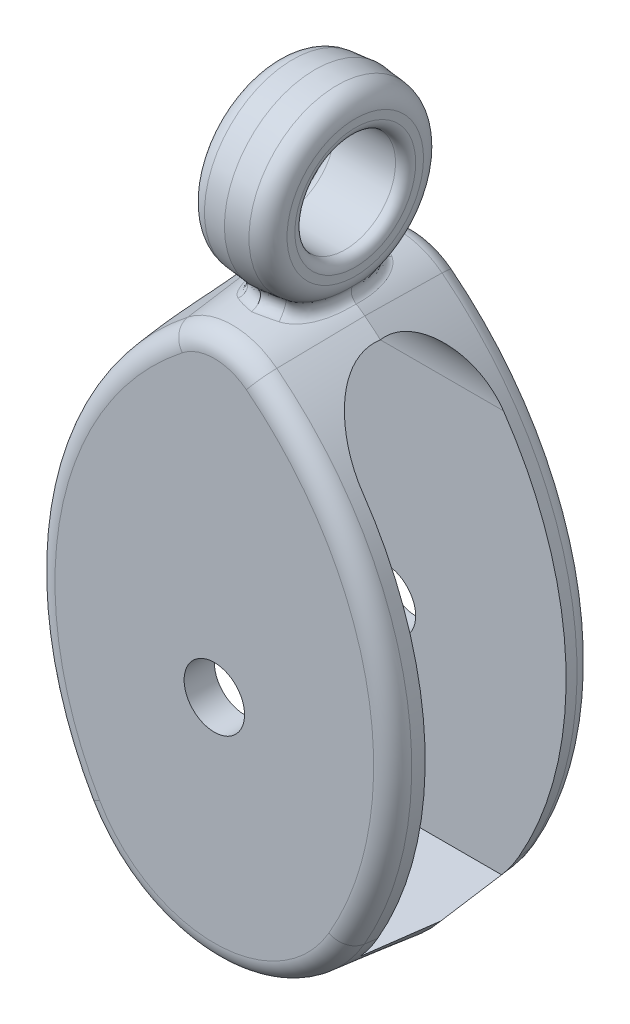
SolidWorks part; units mm, degrees
ref_plane "Front" through (0, 0, 0) normal (0, 0, 1) x (1, 0, 0)
ref_plane "Top" through (0, 0, 0) normal (0, 1, 0) x (1, 0, 0)
ref_plane "Right" through (0, 0, 0) normal (1, 0, 0) x (0, 0, -1)
sketch "Base" plane through (0, 0, 0) normal (0, 0, 1) x (1, 0, 0)
  line L0 (0, 0) -> (0, 16) construction
  arc A0 (-2.4744, 19.1429) -> (2.4744, 19.1429) centre (0, 16) cw
  arc A1 (-6.9282, -4) -> (6.9282, -4) centre (0, 0) ccw
  arc A2 (6.9282, -4) -> (2.4744, 19.1429) centre (-8.6603, 5) ccw
  arc A3 (-6.9282, -4) -> (-2.4744, 19.1429) centre (8.6603, 5) cw
  dimension "D2" = 4
  dimension "D3" = 8
  dimension "D4" = 18
  dimension "D1" = 16
sketch "Hanger" plane through (0, 0, 0) normal (1, 0, 0) x (0, 0, -1)
  line L1 (0, 0) -> (0, 16) construction
  circle A0 centre (0, 24) radius 4.5
  dimension "D2" = 9
  dimension "D1" = 24
sketch "Center Cut" plane through (0, 0, 0) normal (1, 0, 0) x (0, 0, -1)
  line L0 (-3.5, -5) -> (-3.5, 15)
  line L1 (-3.5, -5) -> (3.5, -5)
  line L2 (3.5, -5) -> (3.5, 15)
  arc A0 (3.5, 15) -> (-3.5, 15) centre (0, 15) ccw
  circle A2 centre (0, 24) radius 4.5 construction
  dimension "D1" = 9
  dimension "D2" = 20
  dimension "D3" = 7
extrude "Boss-Extrude1" add sketch "Base" along normal mid plane 10 draft 6
extrude "Boss-Extrude2" add sketch "Hanger" along normal mid plane 4 draft 6
extrude "Cut-Extrude1" cut sketch "Center Cut" against normal up to next and the other way through all
hole_wizard "Ø5.0 (5) Diameter Hole1" positions "Sketch4" profile "Sketch3" hole size "Ø5.0" standard "ANSI Metric"
sketch "Sketch4" plane through (2, 0, 0) normal (1, 0, 0) x (0, 0, -1)
  point P0 (0, 24)
sketch "Sketch3" plane through (2, 24, 0) normal (0, 1, 0) x (0, 0, -1)
  line L0 (0, 0) -> (0, 10.9719)
  line L1 (0, 10.9719) -> (2.5, 10.9719)
  line L2 (2.5, 10.9719) -> (2.5, 0)
  line L5 (2.5, 0) -> (0, 0)
  line L11 (0, -6.35) -> (0, 107.95) construction
  dimension "Thru Hole Dia." = 5
  dimension "Thru Hole Depth" = 10.9719
hole_wizard "Ø3.0 (3) Diameter Hole1" positions "Sketch2" profile "Sketch1" hole size "Ø3.0" standard "ANSI Metric"
sketch "Sketch2" plane through (0, 0, 5) normal (0, 0, 1) x (1, 0, 0)
  point P0 (0, 4)
  dimension "D1" = 4
sketch "Sketch1" plane through (0, 4, 5) normal (1, 0, 0) x (0, -1, 0)
  line L0 (0, 0) -> (0, 10)
  line L1 (0, 10) -> (1.5, 10)
  line L2 (1.5, 10) -> (1.5, 0)
  line L5 (1.5, 0) -> (0, 0)
  line L11 (0, -6.35) -> (0, 107.95) construction
  dimension "Thru Hole Dia." = 3
  dimension "Thru Hole Depth" = 10
fillet "Fillet-1" radius 1 10 edges at (8.4993, 8.3024, -5) (0, 19.4745, -5) (-8.4993, 8.3024, 5) (0, -7.4745, 5) (8.4993, 8.3024, 5) (0, 19.4745, 5) (-2, 24, -4.2898) (2, 24, -4.2898) (-8.4993, 8.3024, -5) (0, -7.4745, -5)
fillet "Fillet-0.5" radius 0.5 10 edges at (-2, 24, -2.5) (2, 24, -2.5) (1.3141, 19.7075, -0.6322) (1.2992, 19.7085, 0.6707) (0.4554, 19.8136, 1.5152) (0.4554, 19.8136, -1.5152) (-0.4554, 19.8136, -1.5152) (-0.4554, 19.8136, 1.5152) (-1.3141, 19.7075, 0.6322) (-1.2992, 19.7085, -0.6707)
